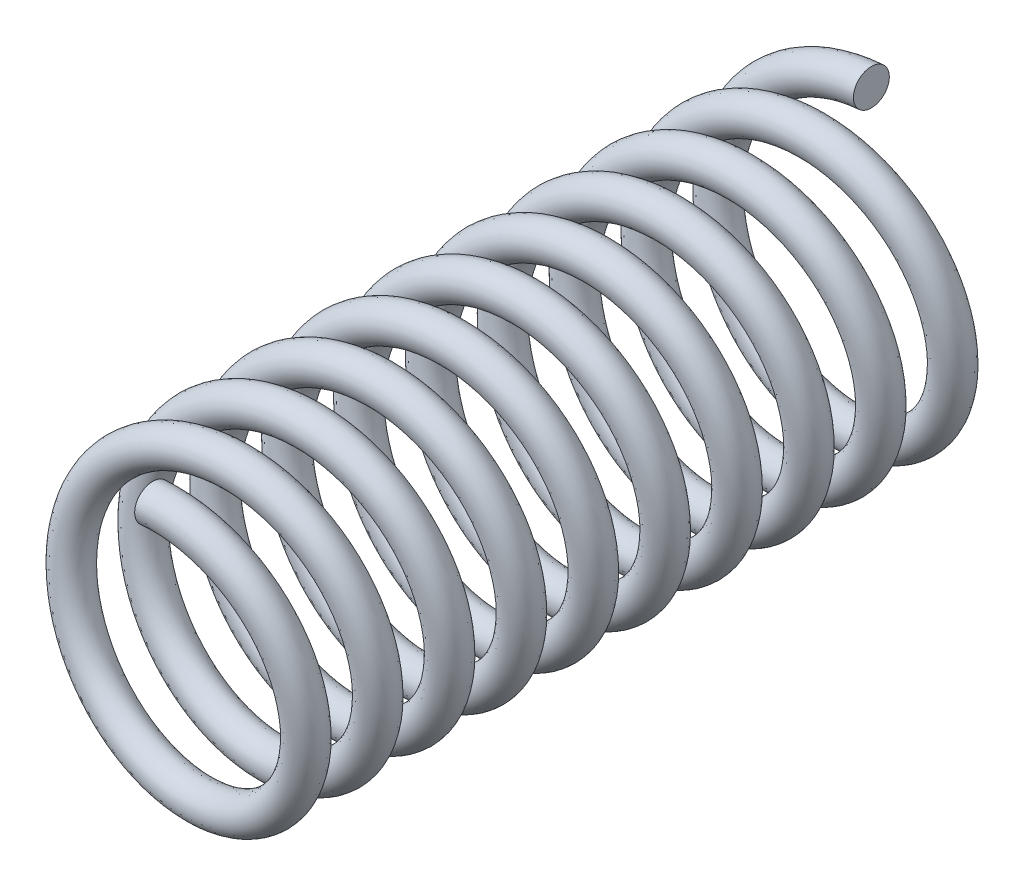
SolidWorks part; units mm, degrees
ref_plane "Ebene vorne" through (0, 0, 0) normal (0, 0, 1) x (1, 0, 0)
ref_plane "Ebene oben" through (0, 0, 0) normal (0, 1, 0) x (1, 0, 0)
ref_plane "Ebene rechts" through (0, 0, 0) normal (1, 0, 0) x (0, 0, -1)
sketch "Skizze1" plane through (0, 0, 0) normal (0, 0, 1) x (1, 0, 0)
  circle A0 centre (0, 0) radius 37.5
  dimension "D1" = 75
curve "Spirale/Helix1"
sketch "Skizze2" plane through (0, 0, 0) normal (1, 0, 0) x (0, 0, -1)
  circle A0 centre (0, 37.5) radius 5
  dimension "D1" = 10
sweep "Austragung1" add profiles "Skizze2" path "Spirale/Helix1"
